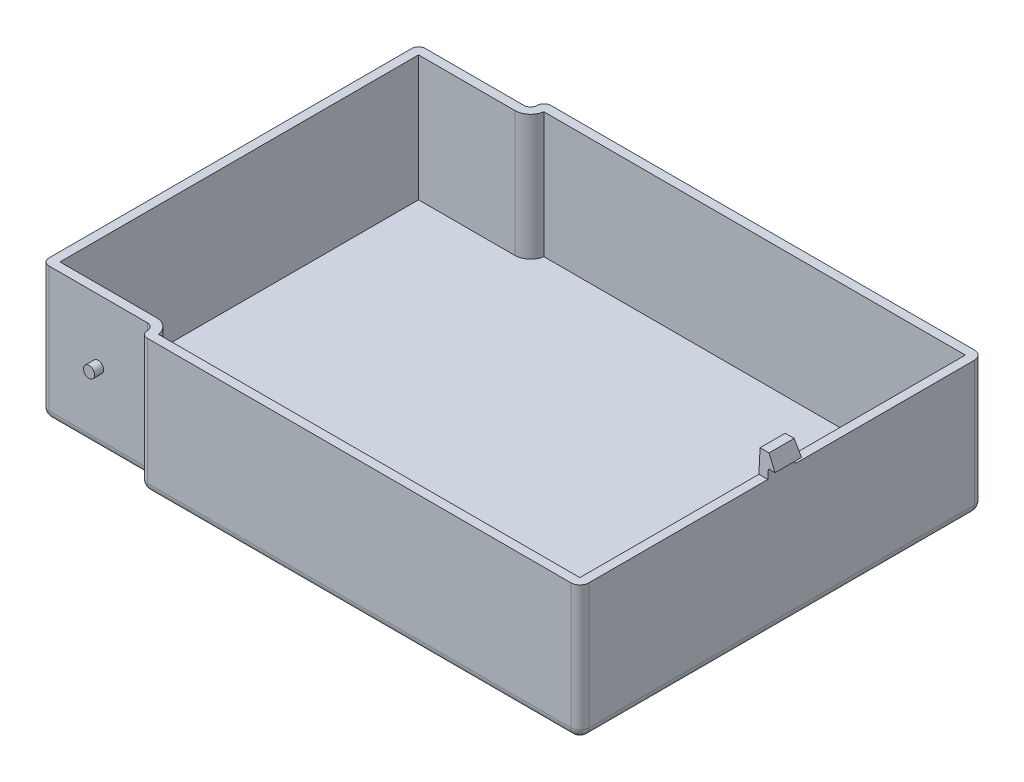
SolidWorks part; units mm, degrees
other "<Figure 11-54-2>-<Stock-Figure 11-59-1>"
ref_plane "Front Plane" through (0, 0, 0) normal (0, 0, 1) x (1, 0, 0)
ref_plane "Top Plane" through (0, 0, 0) normal (0, 1, 0) x (1, 0, 0)
ref_plane "Right Plane" through (0, 0, 0) normal (1, 0, 0) x (0, 0, -1)
sketch "Sketch1" plane through (0, 0, 0) normal (0, 1, 0) x (1, 0, 0)
  line L0 (-36.5, 45) -> (-36.5, 42)
  line L1 (-36.5, -45) -> (61.5, -45)
  line L2 (-61.5, -42) -> (-61.5, 42)
  line L3 (-36.5, 45) -> (61.5, 45)
  line L4 (61.5, -45) -> (61.5, 45)
  line L5 (-36.5, 42) -> (-61.5, 42)
  line L6 (-61.5, 0) -> (61.5, 0) construction
  line L8 (-36.5, -42) -> (-61.5, -42)
  line L9 (-36.5, -45) -> (-36.5, -42)
  dimension "D1" = 123
  dimension "D2" = 3
  dimension "D3" = 90
  dimension "D4" = 25
extrude "Extrude1" add sketch "Sketch1" along normal blind 30
fillet "Fillet1" radius 1.5 6 edges at (-36.5, 15, -45) (-36.5, 15, 45) (-36.5, 15, -42) (-61.5, 15, -42) (-61.5, 15, 42) (-36.5, 15, 42)
fillet "Fillet3" radius 2 2 edges at (61.5, 15, -45) (61.5, 15, 45)
fillet "Fillet2" radius 2 14 edges at (12.25, 0, -45) (-36.0607, 0, -44.5607) (-36.9393, 0, -42.4393) (-49, 0, -42) (-61.0607, 0, -41.5607) (-61.5, 0, 0) (-61.0607, 0, 41.5607) (-49, 0, 42) (-36.9393, 0, 42.4393) (-36.0607, 0, 44.5607) (61.5, 0, 0) (12.25, 0, 45) (60.9142, 0, -44.4142) (60.9142, 0, 44.4142)
shell "Shell1" thickness 2
sketch "Sketch2" plane through (0, 0, 42) normal (0, 0, 1) x (1, 0, 0)
  line L0 (-60, 30) -> (-38, 2) construction
  circle A0 centre (-49, 16) radius 1.25
  dimension "D1" = 2.5
extrude "Extrude2" add sketch "Sketch2" along normal blind 2
mirror "Mirror1" about plane through (0, 0, 0) normal (0, 0, 1) of "Extrude2"
sketch3d "3DSketch1"
  point P0 (61.5, 30, 0)
other "Snap Hook1" parameters "BaseDepth"=2, "TopDepth"=2, "Width"=5.6, "HookHeight"=3, "Overhang"=1.5, "BodyHeight"=2, "Draft"=3, "LipHeight"=0
inserted part "Figure 11-54-2"
move or copy body "Body-Move/Copy2"
other "Distance2" parameters "D1"=1
